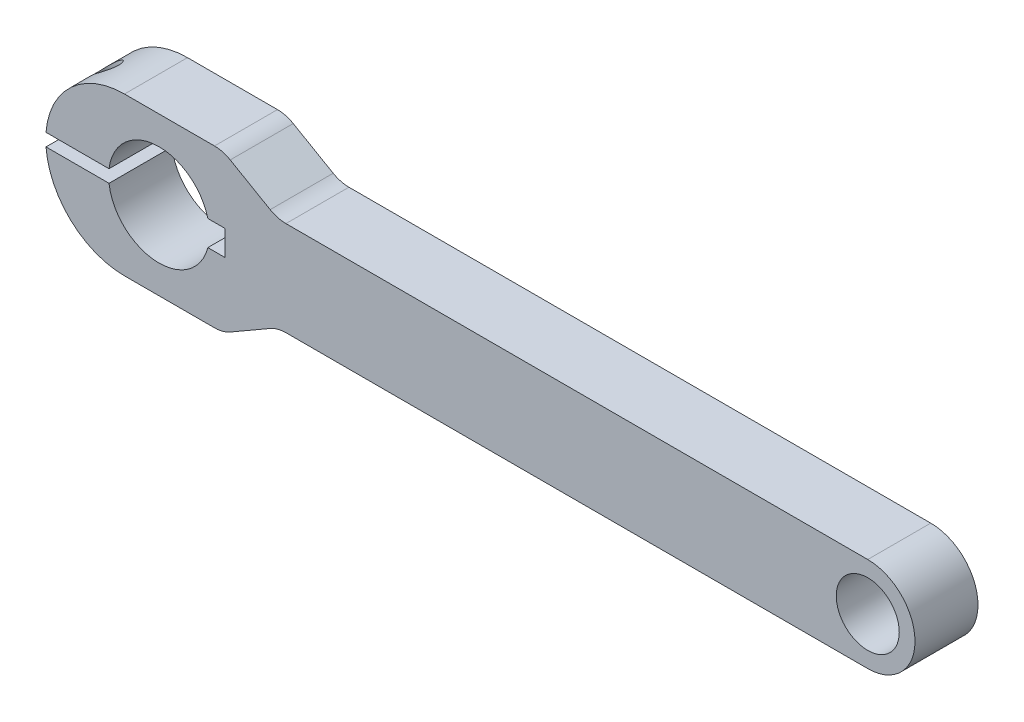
SolidWorks part; units mm, degrees
ref_plane "Plan de face" through (0, 0, 0) normal (0, 0, 1) x (1, 0, 0)
ref_plane "Plan de dessus" through (0, 0, 0) normal (0, 1, 0) x (1, 0, 0)
ref_plane "Plan de droite" through (0, 0, 0) normal (1, 0, 0) x (0, 0, -1)
sketch "Esquisse1" plane through (0, 0, 0) normal (0, 0, 1) x (1, 0, 0)
  line L0 (-75, 177.4931) -> (-300, 177.4931) construction
  line L1 (-262.3913, 162.4931) -> (-75, 162.4931)
  line L3 (-300, 202.4931) -> (-279.7118, 202.4931)
  line L4 (-300, 152.4931) -> (-279.7118, 152.4931)
  line L5 (-262.3913, 192.4931) -> (-75, 192.4931)
  line L6 (-279.7118, 152.4931) -> (-262.3913, 162.4931)
  line L7 (-279.7118, 202.4931) -> (-262.3913, 192.4931)
  circle A0 centre (-300, 177.4931) radius 16
  circle A1 centre (-75, 177.4931) radius 10
  arc A2 (-300, 202.4931) -> (-300, 152.4931) centre (-300, 177.4931) ccw
  arc A3 (-75, 162.4931) -> (-75, 192.4931) centre (-75, 177.4931) ccw
  dimension "D1" = 32
  dimension "D3" = 15
  dimension "D4" = 50
  dimension "D7" = 20
  dimension "D2" = 225
  dimension "D5" = 30
  dimension "D6" = 30
extrude "Boss.-Extru.1" add sketch "Esquisse1" along normal blind 20
fillet "Congé1" radius 10 4 edges at (-262.3913, 162.4931, 10) (-279.7118, 152.4931, 10) (-279.7118, 202.4931, 10) (-262.3913, 192.4931, 10)
sketch "Esquisse2" plane through (0, 0, 20) normal (0, 0, 1) x (1, 0, 0)
  line L1 (-279, 181.4931) -> (-308.8713, 181.4931)
  line L2 (-279, 181.4931) -> (-279, 173.4931)
  line L3 (-279, 173.4931) -> (-308.8713, 173.4931)
  line L4 (-308.8713, 181.4931) -> (-308.8713, 173.4931)
  circle A0 centre (-300, 177.4931) radius 16 construction
  dimension "D1" = 4
  dimension "D2" = 8
  dimension "D3" = 21
extrude "Enlèv. mat.-Extru.1" cut sketch "Esquisse2" against normal through all
sketch "Esquisse3" plane through (0, 0, 0) normal (0, 0, -1) x (-1, 0, 0)
  line L0 (310.961, 202.4931) -> (294.8795, 202.4931)
  line L2 (282.3913, 202.4931) -> (300, 202.4931) construction
  line L4 (310.961, 152.4931) -> (296.0103, 152.4931)
  line L5 (300, 152.4931) -> (282.3913, 152.4931) construction
  line L6 (294.8795, 202.4931) -> (293.7381, 195.6141)
  line L7 (296.0103, 152.4931) -> (293.7381, 159.372)
  arc A0 (310.961, 152.4931) -> (310.961, 202.4931) centre (310.961, 177.4931) ccw
  arc A1 (293.7381, 159.372) -> (293.7381, 195.6141) centre (300, 177.4931) ccw
  dimension "D1" = 50
extrude "Boss.-Extru.2" add sketch "Esquisse3" against normal blind 20
sketch "Esquisse4" plane through (0, 0, 0) normal (0, 0, -1) x (-1, 0, 0)
  line L0 (300, 177.4931) -> (346.4121, 177.4931) construction
  line L1 (314.0952, 179.4931) -> (338.1046, 179.4931)
  line L2 (314.0952, 179.4931) -> (314.0952, 175.4931)
  line L3 (314.0952, 175.4931) -> (338.1046, 175.4931)
  line L4 (338.1046, 179.4931) -> (338.1046, 175.4931)
  dimension "D1" = 2
  dimension "D2" = 2
extrude "Enlèv. mat.-Extru.2" cut sketch "Esquisse4" against normal blind 20
sketch "Esquisse5" plane through (0, 179.4931, 0) normal (0, -1, 0) x (1, 0, 0)
  circle A0 centre (-326.2975, 10) radius 3.5
  dimension "D1" = 7
extrude "Enlèv. mat.-Extru.3" cut sketch "Esquisse5" against normal blind 36
sketch "Esquisse6" plane through (0, 175.4931, 0) normal (0, 1, 0) x (1, 0, 0)
  circle A0 centre (-326.2975, -10) radius 4.5
  dimension "D1" = 9
extrude "Enlèv. mat.-Extru.4" cut sketch "Esquisse6" against normal blind 36
ref_plane "Plan1" through (0, 170.4931, 0) normal (0, 1, 0) x (-1, 0, 0)
sketch "Esquisse7" plane through (0, 170.4931, 0) normal (0, 1, 0) x (-1, 0, 0)
  circle A0 centre (326.2975, 10) radius 7
  dimension "D1" = 14
extrude "Enlèv. mat.-Extru.5" cut sketch "Esquisse7" against normal blind 36
